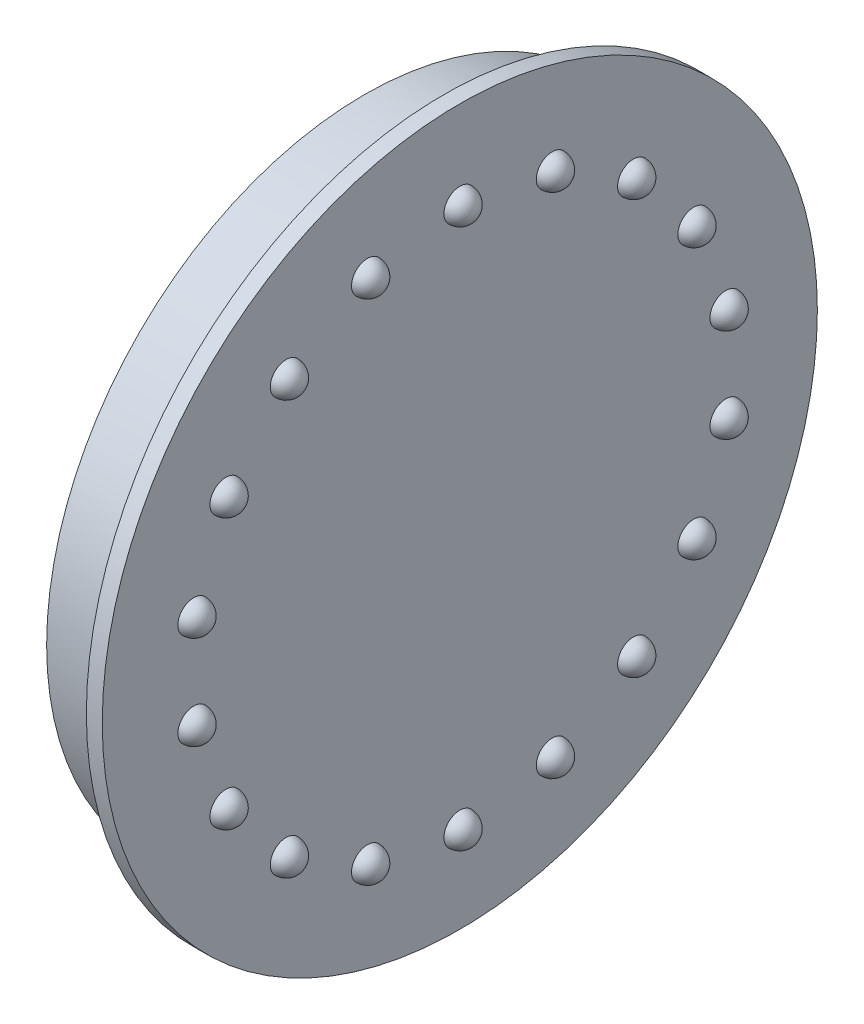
SolidWorks part; units mm, degrees
ref_plane "Front" through (0, 0, 0) normal (0, 0, 1) x (1, 0, 0)
ref_plane "Top" through (0, 0, 0) normal (0, 1, 0) x (1, 0, 0)
ref_plane "Right" through (0, 0, 0) normal (1, 0, 0) x (0, 0, -1)
sketch "Sketch1" plane through (0, 0, 0) normal (1, 0, 0) x (0, 0, -1)
  circle A0 centre (0, 0) radius 20
  dimension "D1" = 40
extrude "Extrude1" add sketch "Sketch1" along normal blind 5
sketch "Sketch2" plane through (5, 0, 0) normal (1, 0, 0) x (0, 0, -1)
  circle A0 centre (0, 0) radius 22.5
  dimension "D1" = 45
extrude "Extrude2" add sketch "Sketch2" along normal blind 1
sketch "Sketch3" plane through (6, 0, 0) normal (1, 0, 0) x (0, 0, -1)
  circle A1 centre (0, -17) radius 1
  circle A2 centre (-5.8143, -15.9748) radius 1
  circle A3 centre (-10.9274, -13.0228) radius 1
  circle A4 centre (-14.7224, -8.5) radius 1
  circle A5 centre (-16.7417, -2.952) radius 1
  circle A6 centre (-16.7417, 2.952) radius 1
  circle A7 centre (-14.7224, 8.5) radius 1
  circle A8 centre (-10.9274, 13.0228) radius 1
  circle A9 centre (-5.8143, 15.9748) radius 1
  circle A10 centre (0, 17) radius 1
  circle A11 centre (5.8143, 15.9748) radius 1
  circle A12 centre (10.9274, 13.0228) radius 1
  circle A13 centre (14.7224, 8.5) radius 1
  circle A14 centre (16.7417, 2.952) radius 1
  circle A15 centre (16.7417, -2.952) radius 1
  circle A16 centre (14.7224, -8.5) radius 1
  circle A17 centre (10.9274, -13.0228) radius 1
  circle A18 centre (5.8143, -15.9748) radius 1
extrude "Extrude3" add sketch "Sketch3" along normal blind 1
fillet "Fillet1" radius 1 1 edges at (7, 15.9748, -6.8143)
fillet "Fillet2" radius 1 17 edges at (7, 13.0228, -11.9274) (7, 8.5, -15.7224) (7, 2.952, -17.7417) (7, -2.952, -17.7417) (7, -8.5, -15.7224) (7, -13.0228, -11.9274) (7, -15.9748, -6.8143) (7, -17, -1) (7, -15.9748, 4.8143) (7, -13.0228, 9.9274) (7, -8.5, 13.7224) (7, -2.952, 15.7417) (7, 2.952, 15.7417) (7, 8.5, 13.7224) (7, 13.0228, 9.9274) (7, 15.9748, 4.8143) (7, 17, -1)
